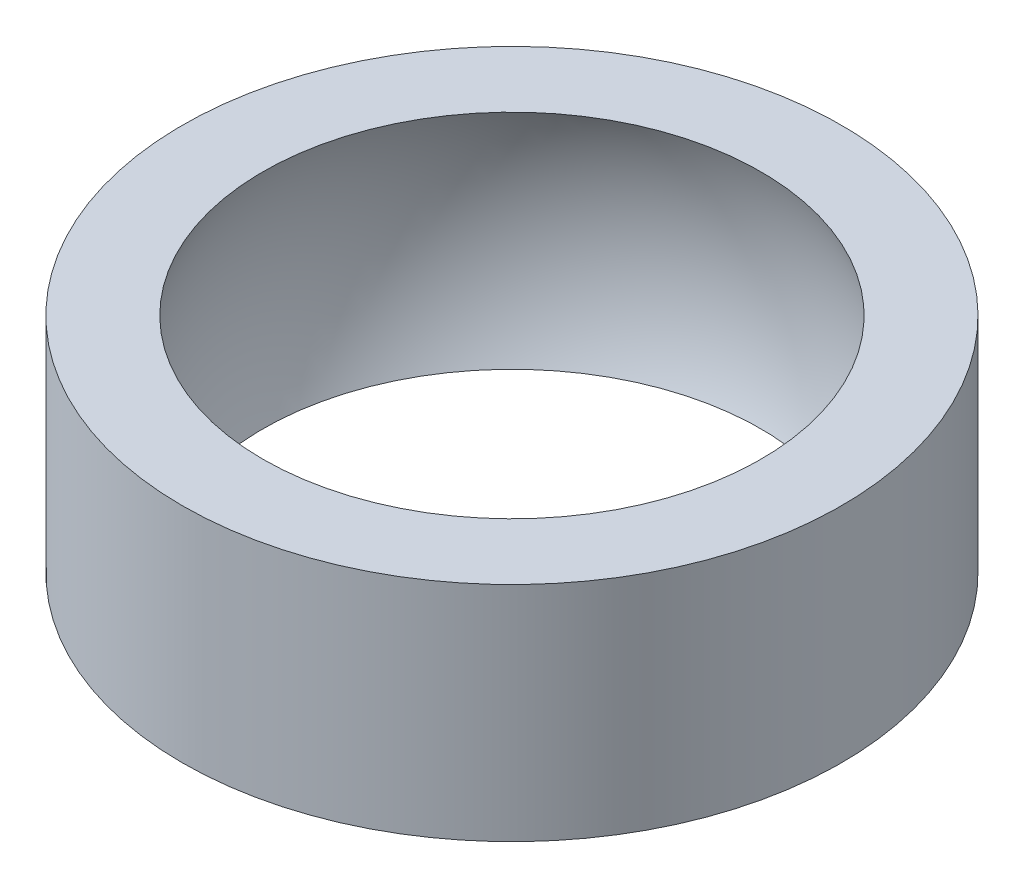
SolidWorks part; units mm, degrees
ref_plane "Plane1" through (0, 0, 0) normal (0, 0, 1) x (1, 0, 0)
ref_plane "Plane2" through (0, 0, 0) normal (0, 1, 0) x (1, 0, 0)
ref_plane "Plane3" through (0, 0, 0) normal (1, 0, 0) x (0, 0, -1)
sketch "Esquisse1" plane through (0, 0, 0) normal (0, 0, 1) x (1, 0, 0)
  line L0 (0, 16.9251) -> (0, -16.9251) construction
  line L1 (-29.6, -10) -> (-22.3663, -10)
  line L2 (-29.6, 10) -> (-22.3663, 10)
  line L3 (-29.6, 10) -> (-29.6, -10)
  arc A0 (-22.3663, 10) -> (-22.3663, -10) centre (0, 0) ccw
  dimension "D1" = 49
  dimension "D2" = 29.6
  dimension "D3" = 20
  dimension "D4" = 10
revolve "Base-Révolution" add sketch "Esquisse1" angle 360 about L0
equation "\"D4@Esquisse1\" = \"D3@Esquisse1\" / 2"
